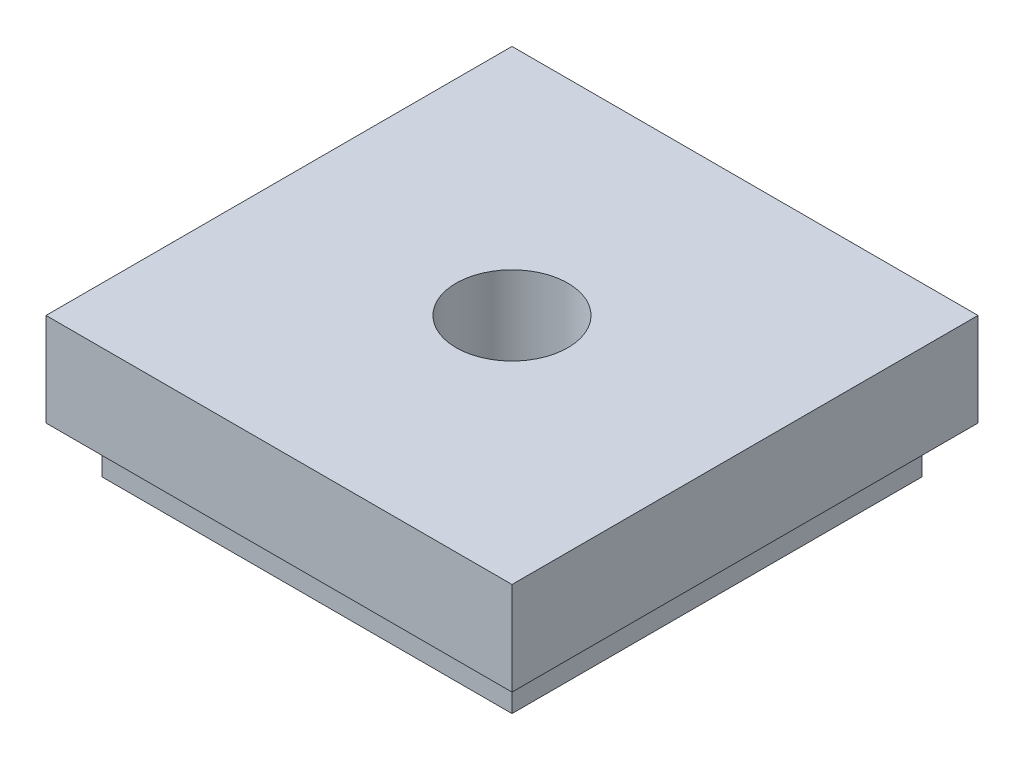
SolidWorks part; units mm, degrees
ref_plane "Plan de face" through (0, 0, 0) normal (0, 0, 1) x (1, 0, 0)
ref_plane "Plan de dessus" through (0, 0, 0) normal (0, 1, 0) x (1, 0, 0)
ref_plane "Plan de droite" through (0, 0, 0) normal (1, 0, 0) x (0, 0, -1)
sketch "Esquisse1" plane through (0, 0, 0) normal (0, 1, 0) x (1, 0, 0)
  line L1 (50, 50) -> (0, 50)
  line L2 (50, 50) -> (50, 0)
  line L3 (50, 0) -> (0, 0)
  line L4 (0, 50) -> (0, 0)
  dimension "D1" = 50
  dimension "D2" = 50
extrude "Extrusion1" add sketch "Esquisse1" along normal blind 10
sketch "Esquisse2" plane through (0, 0, 0) normal (0, -1, 0) x (1, 0, 0)
  line L0 (50, 0) -> (50, -50) construction
  line L1 (3, -3) -> (47, -3)
  line L2 (3, -3) -> (3, -47)
  line L3 (3, -47) -> (47, -47)
  line L4 (47, -3) -> (47, -47)
  line L5 (5, -5) -> (45, -5)
  line L6 (5, -5) -> (5, -45)
  line L7 (5, -45) -> (45, -45)
  line L8 (45, -5) -> (45, -45)
  line L9 (0, -50) -> (0, 0) construction
  line L10 (50, -50) -> (0, -50) construction
  line L11 (0, 0) -> (50, 0) construction
  dimension "D1" = 3
  dimension "D2" = 3
  dimension "D3" = 3
  dimension "D4" = 3
  dimension "D5" = 2
  dimension "D6" = 2
  dimension "D7" = 2
  dimension "D8" = 2
extrude "Extrusion2" add sketch "Esquisse2" along normal blind 5
sketch "Esquisse4" plane through (0, 10, 0) normal (0, 1, 0) x (-1, 0, 0)
  line L0 (0, -50) -> (-50, 0) construction
  line L1 (-50, -50) -> (0, 0) construction
  circle A0 centre (-25, -25) radius 6
  dimension "D1" = 12
extrude "Extrusion3" cut sketch "Esquisse4" against normal blind 10
